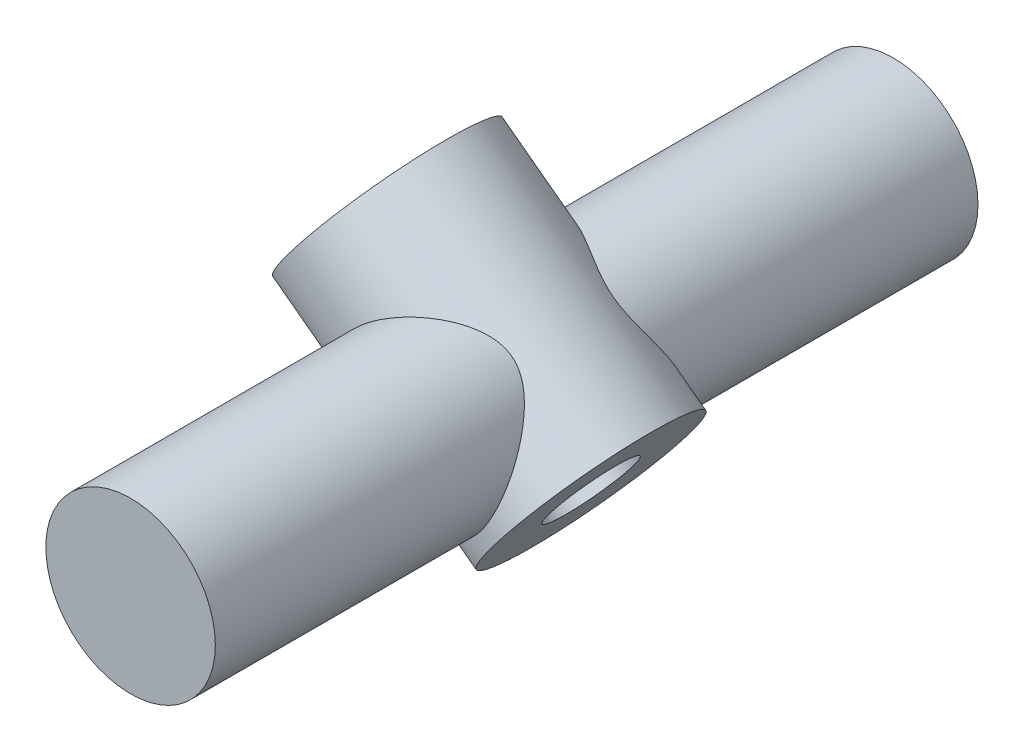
SolidWorks part; units mm, degrees
ref_plane "Alzado" through (0, 0, 0) normal (0, 0, 1) x (1, 0, 0)
ref_plane "Planta" through (0, 0, 0) normal (0, 1, 0) x (1, 0, 0)
ref_plane "Vista lateral" through (0, 0, 0) normal (1, 0, 0) x (0, 0, -1)
sketch3d "Sk_Puente"
  line L0 (-215.7592, 344.7566, -27) -> (-215.7592, 344.7566, 27)
sweep "Puente" add path "Sk_Puente" parameters "D3"=12
sketch3d "Sk_Boss_tornillo"
  line L0 (-210.1546, 340.5627, 0) -> (-224.5664, 351.347, 0)
  dimension "D1" = 18
sweep "Boss_tornillo" add path "Sk_Boss_tornillo" parameters "D3"=14
sketch3d "Sk_Taladro_tornillo"
  line L0 (-209.3539, 339.9636, 0) -> (-225.367, 351.9461, 0)
  dimension "D1" = 20
sweep "Taladro_tornillo" cut path "Sk_Taladro_tornillo" parameters "D3"=6
